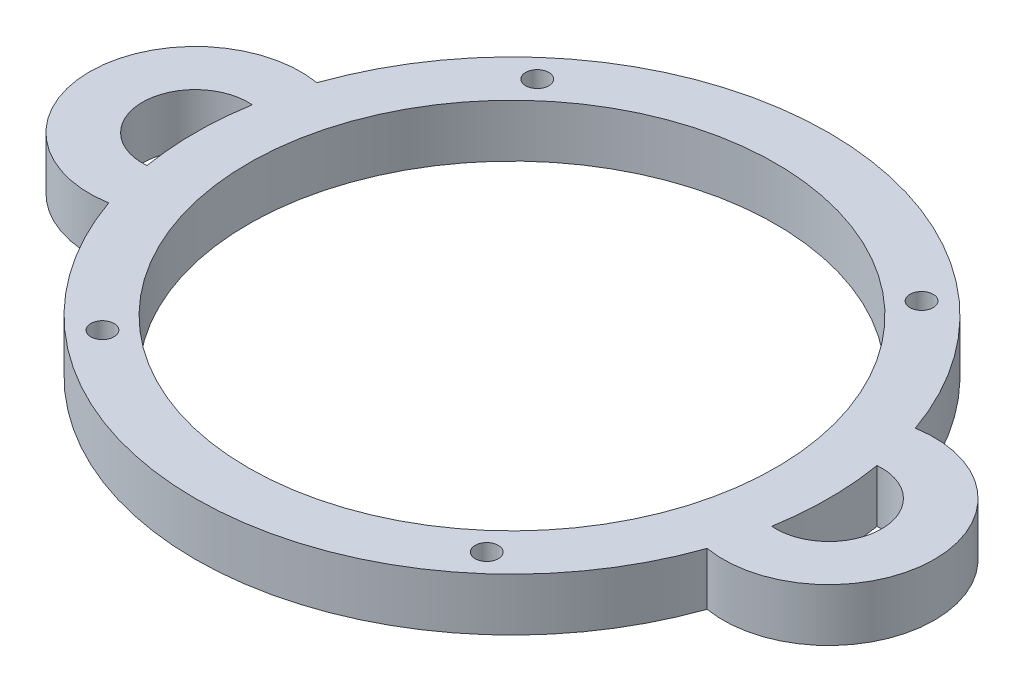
SolidWorks part; units mm, degrees
ref_plane "Front Plane" through (0, 0, 0) normal (0, 0, 1) x (1, 0, 0)
ref_plane "Top Plane" through (0, 0, 0) normal (0, 1, 0) x (1, 0, 0)
ref_plane "Right Plane" through (0, 0, 0) normal (1, 0, 0) x (0, 0, -1)
sketch "Sketch1" plane through (0, 0, 0) normal (0, 1, 0) x (1, 0, 0)
  line L0 (0, 0) -> (0, 60.0569) construction
  line L1 (0, 0) -> (0, -60.0569) construction
  line L2 (0, 0) -> (60.0569, 0) construction
  line L3 (0, 0) -> (-60.0569, 0) construction
  line L4 (0, 0) -> (-39.7723, 45) construction
  line L5 (0, 0) -> (39.7723, 45) construction
  line L6 (0, 0) -> (-39.7723, -45) construction
  line L7 (0, 0) -> (39.7723, -45) construction
  line L8 (-36.4297, 41.218) -> (36.4297, 41.218) construction
  line L9 (36.4297, 41.218) -> (36.4297, -41.218) construction
  line L10 (36.4297, -41.218) -> (-36.4297, -41.218) construction
  arc A0 (56.7204, 19.739) -> (-56.7204, 19.739) centre (0, 0) ccw
  circle A1 centre (0, 0) radius 50
  arc A2 (-59.2228, 9.9747) -> (-59.2228, -9.9747) centre (-60.0569, 0) ccw
  arc A3 (-56.7204, 19.739) -> (-56.7204, -19.739) centre (-60.0569, 0) ccw
  arc A4 (59.2228, -9.9747) -> (59.2228, 9.9747) centre (60.0569, 0) ccw
  arc A5 (56.7204, -19.739) -> (56.7204, 19.739) centre (60.0569, 0) ccw
  arc A6 (59.2228, -9.9747) -> (59.2228, 9.9747) centre (0, 0) ccw
  arc A7 (-59.2228, 9.9747) -> (-59.2228, -9.9747) centre (0, 0) ccw
  arc A8 (-56.7204, -19.739) -> (56.7204, -19.739) centre (0, 0) ccw
  circle A9 centre (-36.4297, 41.218) radius 2.2
  circle A10 centre (36.4297, 41.218) radius 2.2
  circle A11 centre (-36.4297, -41.218) radius 2.2
  circle A12 centre (36.4297, -41.218) radius 2.2
  dimension "D1" = 45
extrude "Boss-Extrude1" add sketch "Sketch1" along normal blind 10
